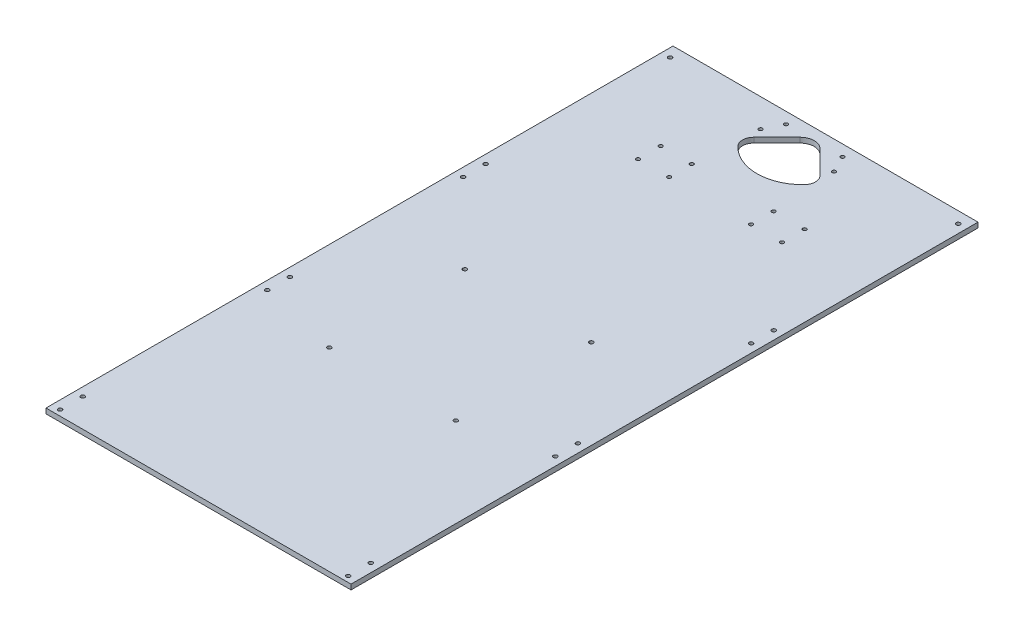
SolidWorks part; units mm, degrees
ref_plane "Front Plane" through (0, 0, 0) normal (0, 0, 1) x (1, 0, 0)
ref_plane "Top Plane" through (0, 0, 0) normal (0, 1, 0) x (1, 0, 0)
ref_plane "Right Plane" through (0, 0, 0) normal (1, 0, 0) x (0, 0, -1)
sketch "Sketch1" plane through (0, 0, 0) normal (0, 1, 0) x (1, 0, 0)
  line L44 (0, 360) -> (0, 320)
  line L45 (0, 320) -> (-100, 320)
  line L46 (-100, 320) -> (-100, 280)
  line L47 (-100, 280) -> (0, 280)
  line L57 (-270, 360) -> (-270, 120)
  line L77 (-50, 140) -> (-50, 100) construction
  line L78 (-240, -990) -> (-240, 360) construction
  line L95 (-255, 140) -> (-255, 100) construction
  line L99 (-255, -940) -> (-255, -593.3333) construction
  line L101 (-255, -940) -> (-255, -980) construction
  line L104 (-255, -593.3333) -> (-255, -246.6667) construction
  line L106 (0, 280) -> (0, 80)
  line L125 (-240, 360) -> (-270, 360)
  line L128 (-270, 360) -> (-270, -990)
  line L135 (-270, -990) -> (-240, -990)
  line L136 (-240, -990) -> (-240, 360) construction
  line L138 (-50, 140) -> (0, 140) construction
  line L141 (0, 100) -> (-50, 100) construction
  line L142 (-255, -246.6667) -> (-255, 100) construction
  line L171 (0, 0) -> (0, -990)
  line L175 (-255, -980) -> (-255, -990) construction
  line L180 (-240, -990) -> (0, -990)
  line L181 (-255, -960) -> (-265, -960) construction
  line L184 (-255, 140) -> (-255, 350) construction
  line L188 (-255, 350) -> (-255, 360) construction
  line L189 (-255, 120) -> (-270, 120) construction
  line L190 (-360, -306.4839) -> (0, -306.4839) construction
  line L191 (-112, -406.4839) -> (112, -406.4839) construction
  line L193 (-112, -406.4839) -> (-112, -646.4839) construction
  line L194 (-112, -646.4839) -> (112, -646.4839) construction
  line L195 (112, -406.4839) -> (112, -646.4839) construction
  line L204 (-270, 120) -> (0, 120)
  line L210 (-17.6777, 92.6777) -> (-70.7107, 39.6447)
  line L212 (-127.5, -44.34) -> (-72.5, -44.34) construction
  line L213 (-127.5, -44.34) -> (-127.5, -84.34) construction
  line L214 (-127.5, -84.34) -> (-72.5, -84.34) construction
  line L215 (-72.5, -44.34) -> (-72.5, -84.34) construction
  line L216 (-50, 140) -> (0, 140) construction
  line L218 (-240, 360) -> (0, 360)
  line L219 (-127.5, -44.34) -> (-72.5, -84.34) construction
  line L220 (-127.5, -84.34) -> (-72.5, -44.34) construction
  circle A16 centre (-50, 100) radius 3.25
  circle A45 centre (-180.25, 276.4049) radius 4 construction
  circle A47 centre (-138.25, 276.4049) radius 4 construction
  circle A49 centre (-180.25, 276.4049) radius 4
  circle A51 centre (-138.25, 276.4049) radius 4
  circle A53 centre (-158.9902, 246.4049) radius 4 construction
  circle A55 centre (-158.9902, 246.4049) radius 4
  arc A57 (0, 100) -> (-17.6777, 92.6777) centre (0, 75) ccw
  circle A59 centre (-112, -406.4839) radius 3.5
  circle A63 centre (-255, 350) radius 3.5
  circle A66 centre (-112, -646.4839) radius 3.5
  circle A69 centre (-255, 140) radius 3.5
  circle A139 centre (-255, -593.3333) radius 3.5 construction
  circle A141 centre (-255, -246.6667) radius 3.5 construction
  arc A152 (-70.7107, 39.6447) -> (0, -1.4159) centre (0, 80) ccw
  circle A154 centre (-65, 70) radius 3.25
  circle A156 centre (-127.5, -44.34) radius 3.25
  circle A158 centre (-72.5, -44.34) radius 3.25
  circle A164 centre (0, 140) radius 3.25
  circle A170 centre (-72.5, -84.34) radius 3.25
  circle A172 centre (-127.5, -84.34) radius 3.25
  circle A184 centre (-255, -226.6667) radius 3.5
  circle A185 centre (-255, -613.3333) radius 3.5
  circle A186 centre (-255, -573.3333) radius 3.5
  circle A187 centre (-255, -266.6667) radius 3.5
  circle A188 centre (-255, 310) radius 3.5
  circle A190 centre (-255, 100) radius 3.5
  circle A192 centre (-255, -980) radius 3.5
  circle A195 centre (-255, -940) radius 3.5
  point P43 (0, -646.4839)
  point P68 (-100, -64.34)
extrude "Boss-Extrude1" add sketch "Sketch1" along normal blind 9
fillet "Fillet1" radius 20 1 edges at (-70.7107, 4.5, -39.6447)
mirror "Mirror1" about plane through (0, 0, 0) normal (1, 0, 0) of "Fillet1", "Boss-Extrude1"
equation "\"D8@Sketch1\"=\"D7@Sketch1\""
equation "\"D24@Sketch1\"=\"D7@Sketch1\""
equation "\"D32@Sketch1\"=\"D7@Sketch1\""
equation "\"D33@Sketch1\"=\"D23@Sketch1\""
